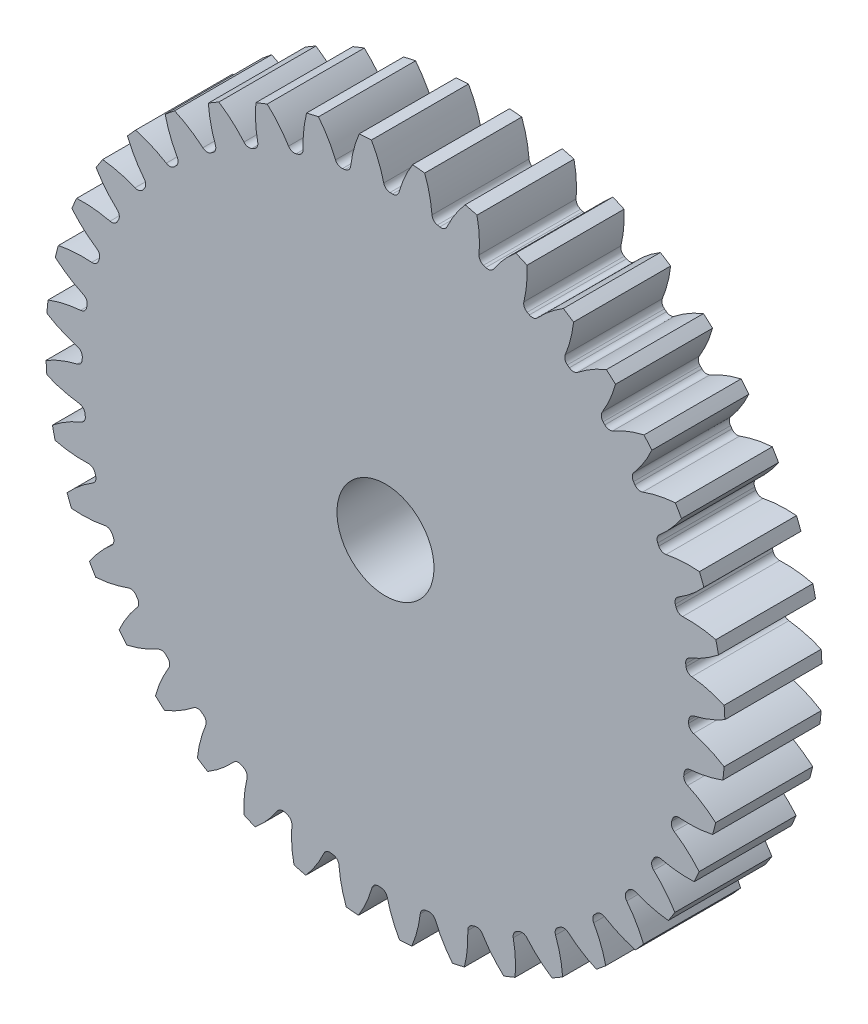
SolidWorks part; units mm, degrees
ref_plane "Front" through (0, 0, 0) normal (0, 0, 1) x (1, 0, 0)
ref_plane "Top" through (0, 0, 0) normal (0, 1, 0) x (1, 0, 0)
ref_plane "Right" through (0, 0, 0) normal (1, 0, 0) x (0, 0, -1)
sketch "Sketch3" plane through (0, 0, 0) normal (0, 0, 1) x (1, 0, 0)
  circle A0 centre (0, 0) radius 355.6
  dimension "od" = 711.2
extrude "gearBody" add sketch "Sketch3" along normal blind 101.6
sketch "Sketch2" plane through (0, 0, 0) normal (0, 0, 1) x (1, 0, 0)
  line L0 (0, 0) -> (294.0178, 121.7862) construction
  line L1 (354.7685, -28.5057) -> (0, 0) construction
  line L2 (0, 0) -> (36.3143, 0) construction
  line L3 (338.5991, 6.7623) -> (338.0916, -19.7273) construction
  line L5 (338.3454, -6.4825) -> (0, 0) construction
  line L7 (0, 0) -> (318.2426, 0) construction
  arc A0 (318.2415, 0.8267) -> (317.9763, -13.0162) centre (0, 0) ccw construction
  arc A1 (355.2952, 14.7204) -> (354.4706, -28.3191) centre (0, 0) ccw construction
  arc A2 (338.5991, 6.7623) -> (338.0916, -19.7273) centre (0, 0) ccw construction
  arc A3 (317.4141, -7.3829) -> (317.464, -4.7809) centre (0, 0) ccw
  arc A4 (354.7685, -28.5057) -> (322.4434, -14.1791) centre (289.137, -132.9591) ccw
  arc A5 (354.7685, -28.5057) -> (355.6, 14.8955) centre (0, 0) ccw
  arc A6 (355.6, 14.8955) -> (322.7499, 1.8176) centre (294.0178, 121.7862) cw
  arc A7 (317.464, -4.7809) -> (322.7499, 1.8176) centre (324.3551, -4.8847) cw
  arc A8 (322.4434, -14.1791) -> (317.4141, -7.3829) centre (324.3042, -7.5432) cw
  point P6 (355.6, 14.8955)
  point P22 (354.7685, -28.5057)
  dimension "baseDia" = 636.4851
  dimension "od" = 711.2
  dimension "pd" = 677.3333
  dimension "rd" = 635
  dimension "rFillet" = 6.8919
  dimension "pointX" = 355.6
  dimension "pointY" = 14.8955
  dimension "CTT" = 26.4896
  dimension "flankCenterAngle" = 22.5
extrude "toothCut" cut sketch "Sketch2" along normal through all
pattern_circular "CirPattern1" count 40 over 360 about axis through (0, 0, 0) along (0, 0, 1) of "toothCut"
sketch "hub1Dia" plane through (0, 0, 0) normal (0, 0, -1) x (-1, 0, 0)
  circle A0 centre (0, 0) radius 12.7
  dimension "hub1Dia" = 25.4
sketch "hub2Dia" plane through (0, 0, 101.6) normal (0, 0, 1) x (1, 0, 0)
  circle A0 centre (0, 0) radius 12.7
  dimension "hub2dia" = 25.4
sketch "boreDia" plane through (0, 0, 0) normal (0, 0, 1) x (1, 0, 0)
  circle A0 centre (0, 0) radius 50.8
  dimension "boreDia" = 101.6
extrude "bore" cut sketch "boreDia" against normal mid plane 25400
